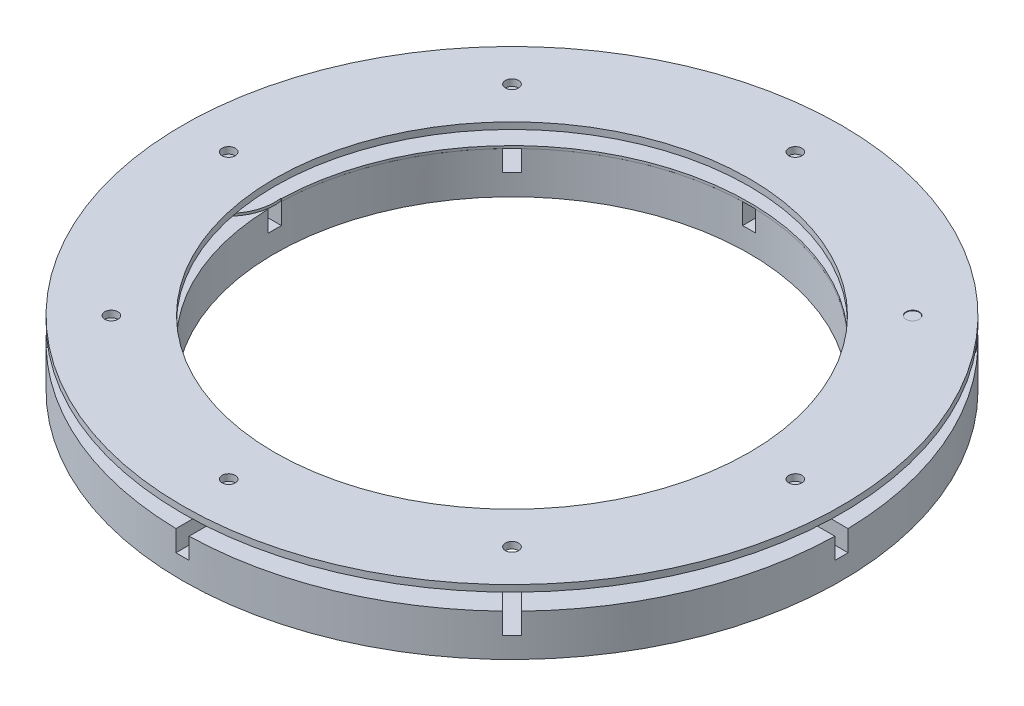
SolidWorks part; units mm, degrees
ref_plane "Front" through (0, 0, 0) normal (0, 0, 1) x (1, 0, 0)
ref_plane "Top" through (0, 0, 0) normal (0, 1, 0) x (1, 0, 0)
ref_plane "Right" through (0, 0, 0) normal (1, 0, 0) x (0, 0, -1)
sketch "Sketch1" plane through (0, 0, 0) normal (0, 1, 0) x (1, 0, 0)
  circle A0 centre (0, 0) radius 23.5 construction
  circle A1 centre (0, 0) radius 36
  circle A2 centre (0, 0) radius 50
  dimension "D1" = 47
  dimension "D2" = 12.5
  dimension "D3" = 100
extrude "Boss-Extrude1" add sketch "Sketch1" along normal mid plane 6.35
sketch "Sketch2" plane through (0, 3.175, 0) normal (0, 1, 0) x (1, 0, 0)
  line L0 (0, 0) -> (0, 60)
  line L1 (0, 0) -> (42.4264, 42.4264)
  line L2 (0, 0) -> (60, 0)
  line L3 (0, 0) -> (42.4264, -42.4264)
  line L4 (0, 0) -> (0, -60)
  line L5 (0, 0) -> (-42.4264, -42.4264)
  line L6 (0, 0) -> (-60, 0)
  line L7 (0, 0) -> (-42.4264, 42.4264)
  point P17 (0, 0)
  dimension "D1" = 60
  dimension "D2" = 8
extrude "Cut-Extrude-Thin1" cut sketch "Sketch2" against normal blind 3.175 thin
ref_plane "Plane2" through (0, 5.675, 0) normal (0, 1, 0) x (1, 0, 0)
sketch "Sketch3" plane through (0, 3.175, 0) normal (0, 1, 0) x (1, 0, 0)
  line L0 (-42.9881, 1) -> (-42.9881, -1) construction
  line L1 (-35.9861, 1) -> (-49.99, 1) construction
  line L2 (-35.9861, -1) -> (-49.99, -1) construction
  line L3 (29.69, 31.1043) -> (31.1043, 29.69) construction
  line L4 (24.7389, 26.1531) -> (34.6412, 36.0554) construction
  line L5 (26.1531, 24.7389) -> (36.0554, 34.6412) construction
  circle A0 centre (0, 0) radius 36 construction
  circle A1 centre (0, 0) radius 50 construction
  circle A2 centre (0, 0) radius 36
  circle A3 centre (0, 0) radius 50
  circle A4 centre (-42.9881, 0) radius 6.9881
  circle A5 centre (30.3971, 30.3971) radius 7.0119
extrude "Boss-Extrude2" add sketch "Sketch3" along normal blind 0.381 separate body contours A4 M3 | A4 M3 | A4 M3 M4 M5 M6 | A5 A3 A2 M5 | A5 A2
sketch "Sketch4" plane through (0, 3.175, 0) normal (0, -1, 0) x (1, 0, 0)
  arc A0 (-36.0719, -1) -> (-49.9042, -1) centre (-42.9881, 0) ccw construction
  arc A1 (-36.0719, -1) -> (-49.9042, -1) centre (-42.9881, 0) ccw
  circle A2 centre (-42.9881, 0) radius 0.975
  dimension "D1" = 1.95
extrude "Boss-Extrude3" add sketch "Sketch4" along normal blind 3.048 separate body contours A2
sketch "Sketch5" plane through (0, 3.556, 0) normal (0, 1, 0) x (1, 0, 0)
  circle A0 centre (30.3971, 30.3971) radius 0.975
  dimension "D1" = 1.95
extrude "Boss-Extrude4" add sketch "Sketch5" along normal blind 3.048
combine bodies "Combine1" operation type add bodies to combine 113 112
sketch "Sketch6" plane through (0, 5.675, 0) normal (0, 1, 0) x (1, 0, 0)
  circle A0 centre (0, 0) radius 50
  circle A1 centre (0, 0) radius 36
  circle A2 centre (-30.3971, 30.3971) radius 1
  circle A3 centre (0, 0) radius 50 construction
  circle A4 centre (0, 0) radius 36 construction
  circle A6 centre (30.3971, 30.3971) radius 1
  circle A7 centre (42.9881, 0) radius 1
  circle A8 centre (30.3971, -30.3971) radius 1
  circle A9 centre (0, -42.9881) radius 1
  circle A10 centre (-30.3971, -30.3971) radius 1
  circle A11 centre (-42.9881, 0) radius 1
  circle A12 centre (0, 42.9881) radius 1
  point P24 (0, 0)
  dimension "D1" = 2
  dimension "D2" = 8
extrude "Boss-Extrude5" add sketch "Sketch6" along normal blind 1 separate body
other "Save Bodies1"
